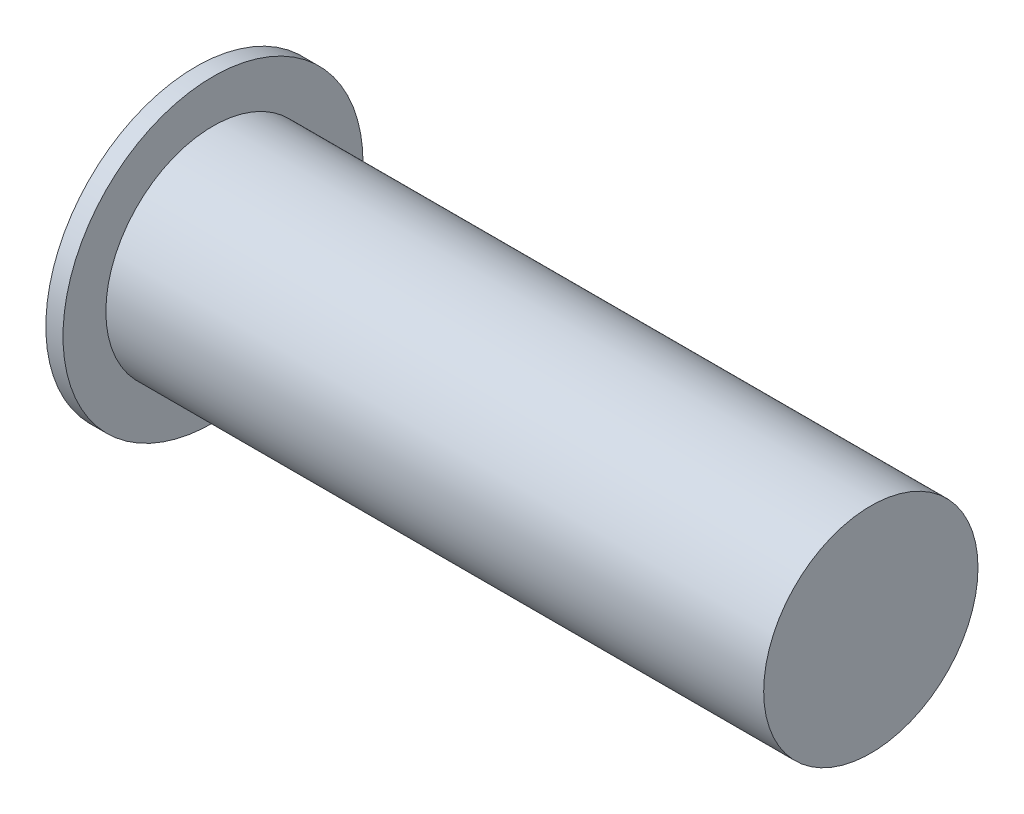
SolidWorks part; units mm, degrees
ref_plane "Front Plane" through (0, 0, 0) normal (0, 0, 1) x (1, 0, 0)
ref_plane "Top Plane" through (0, 0, 0) normal (0, 1, 0) x (1, 0, 0)
ref_plane "Right Plane" through (0, 0, 0) normal (1, 0, 0) x (0, 0, -1)
sketch "Sketch1" plane through (0, 0, 0) normal (0, 1, 0) x (1, 0, 0)
  line L1 (0, 0) -> (-19.49, 0)
  line L2 (0, 0) -> (0, 3.175)
  line L3 (0, 3.175) -> (-19.49, 3.175)
  line L9 (-19.49, -1.27) -> (-19.998, -1.27)
  line L10 (-19.998, -1.27) -> (-19.998, 3.175)
  line L12 (-19.49, 0) -> (-19.49, -1.27)
  line L13 (-19.49, 3.175) -> (-19.998, 3.175)
  dimension "D2" = 3.175
  dimension "D3" = 1.27
revolve "Revolve1" add sketch "Sketch1" angle 360 about L3
sketch "Sketch2" plane through (-19.998, 0, 0) normal (-1, 0, 0) x (0, 0, 1)
  line L2 (-6.1538, 0.3527) -> (0, 0.3527)
  line L3 (0, 0.3527) -> (0, -0.3782)
  line L4 (0, -0.3782) -> (-6.1538, -0.3782)
  line L5 (-6.1538, -0.3782) -> (-6.1538, 0.3527)
extrude "Cut-Extrude1" cut sketch "Sketch2" against normal blind 0.254
